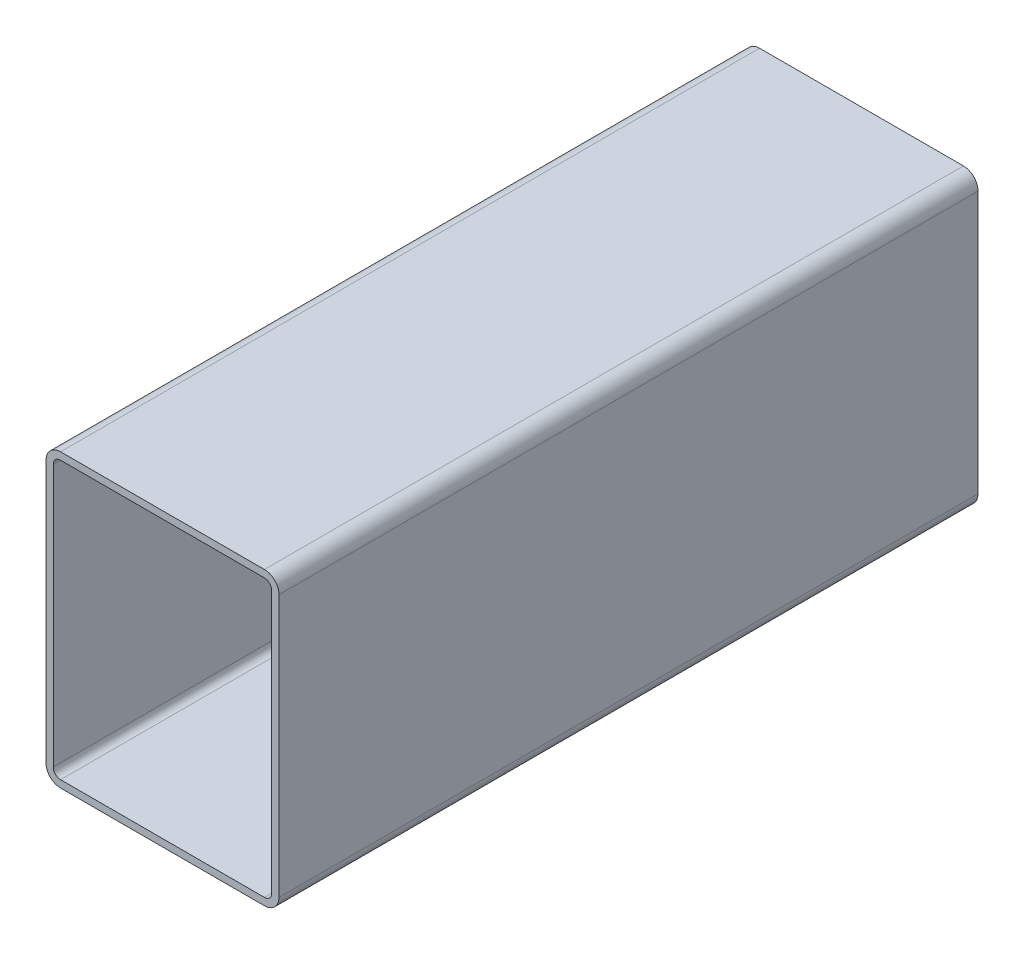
SolidWorks part; units mm, degrees
ref_plane "Front Plane" through (0, 0, 0) normal (0, 0, 1) x (1, 0, 0)
ref_plane "Top Plane" through (0, 0, 0) normal (0, 1, 0) x (1, 0, 0)
ref_plane "Right Plane" through (0, 0, 0) normal (1, 0, 0) x (0, 0, -1)
sketch "Sketch1" plane through (0, 0, 0) normal (0, 0, 1) x (1, 0, 0)
sketch_block_instance "HSS5x4x0.125-1"
sketch_block "HSS5x4x0.125"
extrude "Boss-Extrude1" add sketch "Sketch1" along normal blind 304.8
